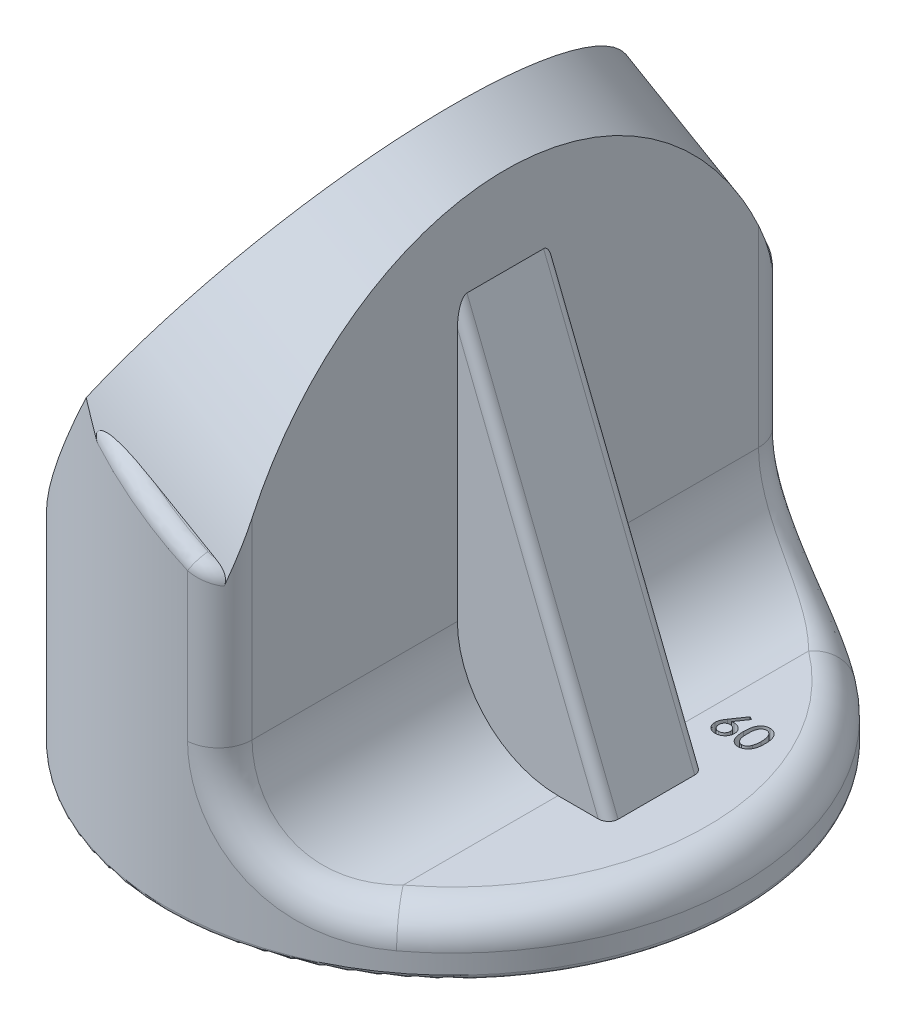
SolidWorks part; units mm, degrees
ref_plane "Front Plane" through (0, 0, 0) normal (0, 0, 1) x (1, 0, 0)
ref_plane "Top Plane" through (0, 0, 0) normal (0, 1, 0) x (1, 0, 0)
ref_plane "Right Plane" through (0, 0, 0) normal (1, 0, 0) x (0, 0, -1)
sketch "Sketch1" plane through (0, 0, 0) normal (0, 1, 0) x (1, 0, 0)
  circle A0 centre (0, 0) radius 30
extrude "Boss-Extrude1" add sketch "Sketch1" along normal blind 80
sketch "Sketch3" plane through (0, 80, 0) normal (0, 1, 0) x (1, 0, 0)
sketch "Sketch4" plane through (0, 0, 0) normal (0, -1, 0) x (-1, 0, 0)
  line L0 (0, 0) -> (-10, 0) construction
  line L1 (0, 0) -> (0, -10) construction
  line L2 (0, 0) -> (0, 10) construction
  line L3 (0, 0) -> (10, 0) construction
  line L5 (-2.5, 2.5) -> (2.5, 2.5)
  line L6 (-2.5, 2.5) -> (-2.5, -2.5)
  line L7 (-2.5, -2.5) -> (2.5, -2.5)
  line L8 (2.5, 2.5) -> (2.5, -2.5)
  line L9 (-2.5, 2.5) -> (2.5, -2.5) construction
  line L10 (-2.5, -2.5) -> (2.5, 2.5) construction
  line L11 (-2.5, -7.5) -> (2.5, -7.5)
  line L12 (-2.5, -7.5) -> (-2.5, -12.5)
  line L13 (-2.5, -12.5) -> (2.5, -12.5)
  line L14 (2.5, -7.5) -> (2.5, -12.5)
  line L15 (-2.5, -7.5) -> (2.5, -12.5) construction
  line L16 (-2.5, -12.5) -> (2.5, -7.5) construction
  line L17 (7.5, 2.5) -> (12.5, 2.5)
  line L18 (7.5, 2.5) -> (7.5, -2.5)
  line L19 (7.5, -2.5) -> (12.5, -2.5)
  line L20 (12.5, 2.5) -> (12.5, -2.5)
  line L21 (7.5, 2.5) -> (12.5, -2.5) construction
  line L22 (7.5, -2.5) -> (12.5, 2.5) construction
  line L23 (-12.5, 2.5) -> (-7.5, 2.5)
  line L24 (-12.5, 2.5) -> (-12.5, -2.5)
  line L25 (-12.5, -2.5) -> (-7.5, -2.5)
  line L26 (-7.5, 2.5) -> (-7.5, -2.5)
  line L27 (-12.5, 2.5) -> (-7.5, -2.5) construction
  line L28 (-12.5, -2.5) -> (-7.5, 2.5) construction
  line L29 (2.5, 7.5) -> (-2.5, 7.5)
  line L30 (2.5, 7.5) -> (2.5, 12.5)
  line L31 (2.5, 12.5) -> (-2.5, 12.5)
  line L32 (-2.5, 7.5) -> (-2.5, 12.5)
  line L33 (2.5, 7.5) -> (-2.5, 12.5) construction
  line L34 (2.5, 12.5) -> (-2.5, 7.5) construction
  dimension "D1" = 5
  dimension "D2" = 5
  dimension "D3" = 5
  dimension "D4" = 5
  dimension "D5" = 5
  dimension "D6" = 5
extrude "Cut-Extrude2" cut sketch "Sketch4" against normal blind 3
fillet "Fillet2" radius 0.5 21 edges at (0, 0, 30) (2.5, 0, 0) (0, 0, 2.5) (-2.5, 0, 0) (0, 0, -2.5) (2.5, 0, 10) (0, 0, 12.5) (-2.5, 0, 10) (0, 0, 7.5) (-7.5, 0, 0) (-10, 0, 2.5) (-12.5, 0, 0) (-10, 0, -2.5) (12.5, 0, 0) (10, 0, 2.5) (7.5, 0, 0) (10, 0, -2.5) (-2.5, 0, -10) (0, 0, -12.5) (2.5, 0, -10) (0, 0, -7.5)
ref_plane "Plane6" through (0, 0, 3.5) normal (0, 0, 1) x (1, 0, 0)
sketch "Sketch13" plane through (0, 0, 3.5) normal (0, 0, 1) x (1, 0, 0)
  line L0 (-30, 6) -> (12.7239, 80)
  line L1 (-30, 80) -> (-30, 0.5) construction
  line L4 (12.7239, 80) -> (-30, 80)
  line L5 (-30, 80) -> (-30, 6)
  line L6 (30, 0.5) -> (-30, 0.5) construction
  dimension "D1" = 5.5
  dimension "D2" = 60
extrude "Cut-Extrude10" cut sketch "Sketch13" against normal mid plane 90
ref_plane "Plane4" through (0, 0, -2.5) normal (0, 0, -1) x (-1, 0, 0)
ref_plane "Plane5" through (0, 0, -62.5) normal (0, 0, -1) x (-1, 0, 0)
sketch "Sketch15" plane through (-25.0981, 14.4904, 0) normal (-0.866, 0.5, 0) x (0.5, 0.866, 0)
  line L0 (-9.8038, 0) -> (0, 0) construction
  line L2 (12.6962, -2.5) -> (7.6962, -2.5)
  line L3 (12.6962, -2.5) -> (12.6962, 2.5)
  line L4 (12.6962, 2.5) -> (7.6962, 2.5)
  line L5 (7.6962, -2.5) -> (7.6962, 2.5)
  line L6 (12.6962, -2.5) -> (7.6962, 2.5) construction
  line L7 (12.6962, 2.5) -> (7.6962, -2.5) construction
  line L8 (22.6962, -2.5) -> (17.6962, -2.5)
  line L9 (22.6962, -2.5) -> (22.6962, 2.5)
  line L10 (22.6962, 2.5) -> (17.6962, 2.5)
  line L11 (17.6962, -2.5) -> (17.6962, 2.5)
  line L12 (22.6962, -2.5) -> (17.6962, 2.5) construction
  line L13 (22.6962, 2.5) -> (17.6962, -2.5) construction
  line L14 (32.6962, -2.5) -> (27.6962, -2.5)
  line L15 (32.6962, -2.5) -> (32.6962, 2.5)
  line L16 (32.6962, 2.5) -> (27.6962, 2.5)
  line L17 (27.6962, -2.5) -> (27.6962, 2.5)
  line L18 (32.6962, -2.5) -> (27.6962, 2.5) construction
  line L19 (32.6962, 2.5) -> (27.6962, -2.5) construction
  line L20 (22.6962, -12.5) -> (17.6962, -12.5)
  line L21 (22.6962, -12.5) -> (22.6962, -7.5)
  line L22 (22.6962, -7.5) -> (17.6962, -7.5)
  line L23 (17.6962, -12.5) -> (17.6962, -7.5)
  line L24 (22.6962, -12.5) -> (17.6962, -7.5) construction
  line L25 (22.6962, -7.5) -> (17.6962, -12.5) construction
  line L26 (22.6962, 7.5) -> (17.6962, 7.5)
  line L27 (22.6962, 7.5) -> (22.6962, 12.5)
  line L28 (22.6962, 12.5) -> (17.6962, 12.5)
  line L29 (17.6962, 7.5) -> (17.6962, 12.5)
  line L30 (22.6962, 7.5) -> (17.6962, 12.5) construction
  line L31 (22.6962, 12.5) -> (17.6962, 7.5) construction
  ellipse E0 centre (50.1962, 0) end of major axis (-9.8038, 0) minor radius 30 construction
  point P9 (10.1962, 0)
  point P14 (20.1962, 0)
  point P19 (30.1962, 0)
  point P24 (20.1962, -10)
  point P29 (20.1962, 10)
  dimension "D1" = 40
  dimension "D2" = 30
  dimension "D3" = 20
  dimension "D4" = 5
  dimension "D5" = 5
  dimension "D6" = 5
  dimension "D7" = 5
  dimension "D8" = 5
  dimension "D9" = 5
  dimension "D10" = 5
  dimension "D11" = 5
  dimension "D12" = 10
  dimension "D13" = 10
  dimension "D14" = 5
  dimension "D15" = 5
extrude "Cut-Extrude11" cut sketch "Sketch15" against normal blind 3
ref_plane "Plane7" through (0, 0, 0) normal (0, 0, -1) x (-1, 0, 0)
sketch "Sketch24" plane through (-25.0981, 14.4904, 0) normal (-0.866, 0.5, 0) x (0.5, 0.866, 0)
  line L0 (20.1962, -30) -> (8.2869, -61.3494)
  line L1 (20.1962, 0) -> (-9.8038, 0)
  line L3 (8.2869, -61.3494) -> (91.449, -58.1784)
  line L4 (91.449, -58.1784) -> (76.5573, 58.2179)
  line L5 (76.5573, 58.2179) -> (20.1962, 46.8115)
  line L6 (20.1962, 46.8115) -> (20.1962, 30)
  arc A0 (20.1962, -30) -> (-9.8038, 0) centre (20.1962, 0) ccw
  ellipse E1 centre (50.1962, 0) end of major axis (-9.8038, 0) minor radius 30 construction
  dimension "D1" = 30
extrude "Cut-Extrude13" cut sketch "Sketch24" against normal blind 100 contours A0 M21
fillet "Fillet8" radius 0.5 4 edges at (-15, 31.9808, -7.5) (-13.75, 34.1458, -10) (-15, 31.9808, -12.5) (-16.25, 29.8157, -10)
fillet "Fillet9" radius 0.5 4 edges at (-10, 40.641, 2.5) (-8.75, 42.8061, 0) (-10, 40.641, -2.5) (-11.25, 38.476, 0)
fillet "Fillet10" radius 0.5 4 edges at (-21.25, 21.1554, 0) (-20, 23.3205, 2.5) (-18.75, 25.4856, 0) (-20, 23.3205, -2.5)
fillet "Fillet11" radius 0.5 4 edges at (-16.25, 29.8157, 10) (-15, 31.9808, 12.5) (-13.75, 34.1458, 10) (-15, 31.9808, 7.5)
fillet "Fillet12" radius 0.5 4 edges at (-16.25, 29.8157, 0) (-15, 31.9808, 2.5) (-13.75, 34.1458, 0) (-15, 31.9808, -2.5)
sketch "Sketch26" plane through (0, 0, 3.5) normal (0, 0, 1) x (1, 0, 0)
  line L1 (21.1305, 54.6487) -> (36.0272, 54.6487)
  line L2 (21.1305, 54.6487) -> (21.1305, 40.5617)
  line L3 (21.1305, 40.5617) -> (36.0272, 40.5617)
  line L4 (36.0272, 54.6487) -> (36.0272, 40.5617)
  line L5 (21.1305, 54.6487) -> (36.0272, 40.5617) construction
  line L6 (21.1305, 40.5617) -> (36.0272, 54.6487) construction
  point P0 (28.5788, 47.6052)
sketch "Sketch27" plane through (-25.0981, 14.4904, 0) normal (-0.866, 0.5, 0) x (0, 0, 1)
  line L0 (28.2843, 30.1962) -> (33.933, 30.1962)
  line L1 (33.933, 30.1962) -> (33.933, 52.9731)
  line L2 (33.933, 52.9731) -> (28.2843, 52.9731)
  line L3 (28.2843, 52.9731) -> (28.2843, 30.1962)
  line L4 (-28.2843, 30.1962) -> (-35.0532, 30.1962)
  line L5 (-35.0532, 30.1962) -> (-35.0532, 54.6027)
  line L6 (-35.0532, 54.6027) -> (-28.2843, 54.6027)
  line L7 (-28.2843, 54.6027) -> (-28.2843, 30.1962)
extrude "Cut-Extrude14" cut sketch "Sketch27" against normal blind 30
sketch "Sketch29" plane through (0, 0, 3.5) normal (0, 0, 1) x (1, 0, 0)
  line L1 (9.0804, 82.4773) -> (38.2479, 82.4773)
  line L2 (9.0804, 82.4773) -> (9.0804, 63.7029)
  line L3 (9.0804, 63.7029) -> (38.2479, 63.7029)
  line L4 (38.2479, 82.4773) -> (38.2479, 63.7029)
extrude "Cut-Extrude15" cut sketch "Sketch29" against normal mid plane 100
sketch "Sketch30" plane through (0, 0, 3.5) normal (0, 0, 1) x (1, 0, 0)
  line L0 (5.4585, 6) -> (30, 6)
  line L1 (30, 0.5) -> (30, 40.641) construction
  line L2 (30, 6) -> (30, 40.641)
  line L3 (30, 40.641) -> (5.4585, 54.81)
  line L4 (30, 40.641) -> (0, 57.9615) construction
  line L5 (5.4585, 54.81) -> (5.4585, 6)
extrude "Cut-Extrude16" cut sketch "Sketch30" against normal mid plane 100
fillet "Fillet13" radius 10.5 1 edges at (5.4585, 6, 0)
fillet "Fillet14" radius 3.5 5 edges at (5.4585, 24.108, -29.4992) (7.6563, 10.0716, -29.0066) (9.2994, 8.3818, 28.5223) (5.4585, 24.108, 29.4992) (30, 6, 0)
fillet "Fillet15" radius 1.5 4 edges at (3.7664, 32.693, -29.4245) (3.7664, 32.693, 29.4245)
sketch "Sketch31" plane through (0, 0, 0) normal (0, 0, -1) x (-1, 0, 0)
  line L0 (-21.2293, 6) -> (-5.4585, 45.6868)
  line L1 (-15.9585, 6) -> (-26.5, 6) construction
  line L2 (-5.4585, 54.81) -> (-5.4585, 36.5636) construction
  line L3 (-5.4585, 45.6868) -> (-5.4585, 6)
  line L4 (-5.4585, 6) -> (-21.2293, 6)
extrude "Boss-Extrude2" add sketch "Sketch31" along normal mid plane 10
fillet "Fillet16" radius 1 2 edges at (13.3439, 25.8434, -5) (13.3439, 25.8434, 5)
sketch "Sketch32" plane through (0, 6, 0) normal (0, 1, 0) x (1, 0, 0)
  text T0 "<b>60</b>"
extrude "Cut-Extrude17" cut sketch "Sketch32" against normal blind 2
